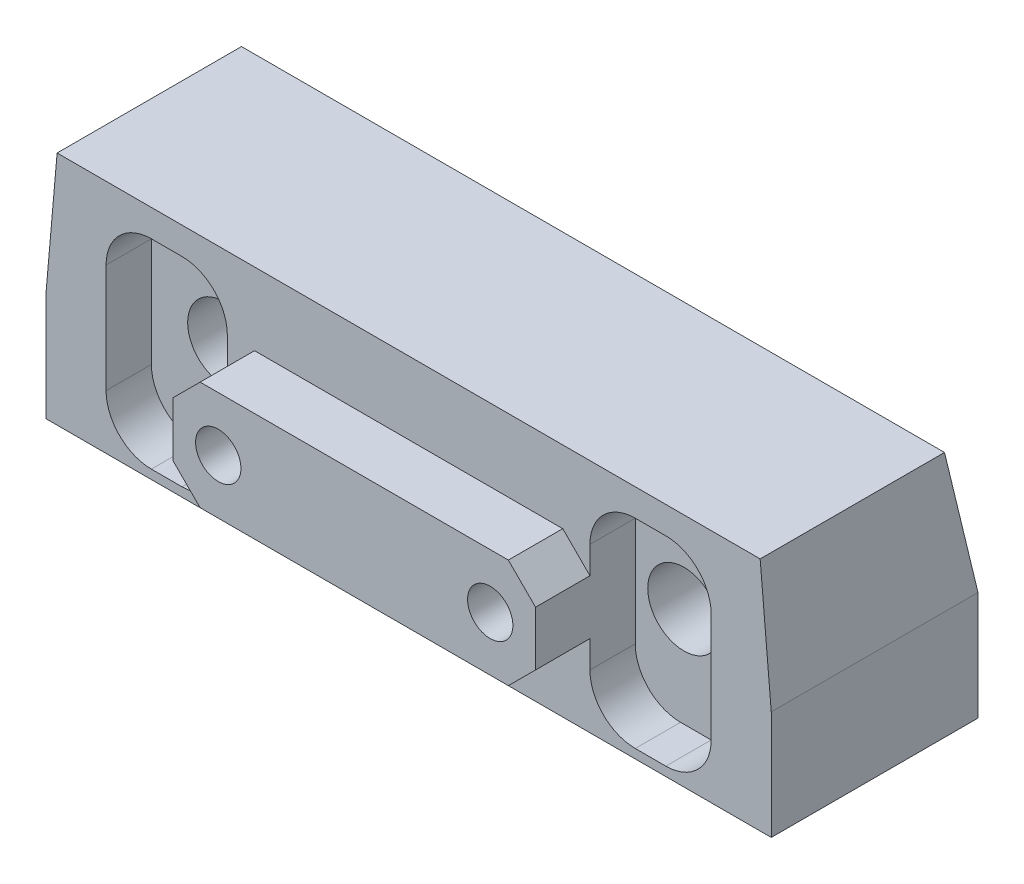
SolidWorks part; units mm, degrees
ref_plane "Plan de face" through (0, 0, 0) normal (0, 0, 1) x (1, 0, 0)
ref_plane "Plan de dessus" through (0, 0, 0) normal (0, 1, 0) x (1, 0, 0)
ref_plane "Plan de droite" through (0, 0, 0) normal (1, 0, 0) x (0, 0, -1)
imported_body "Importée3"
sketch "Esquisse1" plane through (0, 0, 131.6632) normal (0, 0, 1) x (1, 0, 0)
  line L0 (-40, -4.5675) -> (-40, 0)
  line L1 (-40, 0) -> (-38.7752, 14)
  line L2 (-38.7752, 14) -> (38.7752, 14)
  line L3 (38.7752, 14) -> (40, 0)
  line L4 (40, 0) -> (40, -4.5675)
  line L5 (40, -4.5675) -> (-40, -4.5675)
extrude "Boss.-Extru.1" add sketch "Esquisse1" along normal blind 20.3368
sketch "Esquisse2" plane through (0, -4.5675, 0) normal (0, -1, 0) x (1, 0, 0)
  line L0 (40, 152) -> (40, 129.1946)
  line L1 (40, 129.1946) -> (-40, 129.1946)
  line L2 (-40, 129.1946) -> (-40, 152)
  line L3 (-40, 152) -> (40, 152)
extrude "Boss.-Extru.2" add sketch "Esquisse2" along normal blind 7.4325
sketch "Esquisse3" plane through (0, 0, 152) normal (0, 0, 1) x (1, 0, 0)
  line L0 (-33.375, 11) -> (-33.375, -11)
  line L1 (-33.375, -11) -> (-20, -11)
  line L2 (-20, -11) -> (-20, 11)
  line L3 (-20, 11) -> (-33.375, 11)
  dimension "D1" = 22
  dimension "D2" = 13.375
  dimension "D3" = 20
  dimension "D4" = 11
extrude "Enlèv. mat.-Extru.1" cut sketch "Esquisse3" against normal blind 5
sketch "Esquisse4" plane through (0, 0, 152) normal (0, 0, 1) x (1, 0, 0)
  line L0 (-20, 6) -> (20, 6)
  line L1 (20, 6) -> (20, -6)
  line L2 (20, -6) -> (-20, -6)
  line L3 (-20, -6) -> (-20, 6)
extrude "Boss.-Extru.3" add sketch "Esquisse4" along normal blind 6
sketch "Esquisse5" plane through (0, 0, 152) normal (0, 0, 1) x (1, 0, 0)
  line L0 (33.375, 11) -> (20, 11)
  line L1 (20, 11) -> (20, -11)
  line L2 (20, -11) -> (33.375, -11)
  line L3 (33.375, -11) -> (33.375, 11)
extrude "Enlèv. mat.-Extru.2" cut sketch "Esquisse5" against normal blind 5
sketch "Esquisse6" plane through (0, 0, 130) normal (0, 0, -1) x (-1, 0, 0)
  line L0 (-14.1657, -2.5818) -> (-19.9083, -2.5818)
  line L1 (-19.9083, 2.5818) -> (-14.1657, 2.5818)
  line L2 (-14.1657, 2.5818) -> (-14.1657, -2.5818)
  arc A0 (-19.9083, -2.5818) -> (-19.9083, 2.5818) centre (-25.375, 0) ccw
extrude "Boss.-Extru.4" add sketch "Esquisse6" along normal blind 5.075 draft 0.5
sketch "Esquisse7" plane through (0, 0, 130) normal (0, 0, -1) x (-1, 0, 0)
  line L0 (14.1657, 2.5818) -> (19.9083, 2.5818)
  line L1 (19.9083, -2.5818) -> (14.1657, -2.5818)
  line L2 (14.1657, -2.5818) -> (14.1657, 2.5818)
  arc A0 (19.9083, 2.5818) -> (19.9083, -2.5818) centre (25.375, 0) ccw
extrude "Boss.-Extru.5" add sketch "Esquisse7" along normal blind 5.075 draft 0.5
hole_wizard "Perçage1" positions "Esquisse9" profile "Esquisse8" legacy
sketch "Esquisse9" plane through (0, 0, 130) normal (0, 0, -1) x (-1, 0, 0)
  point P0 (25.375, 0)
sketch "Esquisse8" plane through (-25.375, 0, 130) normal (1, 0, 0) x (0, 1, 0)
  line L0 (0, 0) -> (0, 28)
  line L1 (0, 28) -> (4, 28)
  line L2 (4, 28) -> (4, 0)
  line L3 (4, 0) -> (0, 0)
  line L4 (0, 110) -> (0, -10) construction
  dimension "Diamètre" = 8
  dimension "Profondeur" = 28
hole_wizard "Perçage2" positions "Esquisse11" profile "Esquisse10" legacy
sketch "Esquisse11" plane through (0, 0, 130) normal (0, 0, -1) x (-1, 0, 0)
  point P0 (-25.375, 0)
sketch "Esquisse10" plane through (25.375, 0, 130) normal (1, 0, 0) x (0, 1, 0)
  line L0 (0, 0) -> (0, 28)
  line L1 (0, 28) -> (4, 28)
  line L2 (4, 28) -> (4, 0)
  line L3 (4, 0) -> (0, 0)
  line L4 (0, 110) -> (0, -10) construction
  dimension "Diamètre" = 8
  dimension "Profondeur" = 28
hole_wizard "Perçage3" positions "Esquisse13" profile "Esquisse12" legacy
sketch "Esquisse13" plane through (0, 0, 158) normal (0, 0, 1) x (1, 0, 0)
  point P0 (15, 0)
sketch "Esquisse12" plane through (15, 0, 158) normal (1, 0, 0) x (0, -1, 0)
  line L0 (0, 0) -> (0, 17.6906)
  line L1 (0, 17.6906) -> (2.5, 16.2472)
  line L2 (2.5, 16.2472) -> (2.5, 0)
  line L4 (2.5, 0) -> (0, 0)
  line L6 (0, 17.6906) -> (-2.5, 16.2472) construction
  line L7 (0, -4.2442) -> (0, 117.3081) construction
  dimension "Diamètre" = 5
  dimension "Profondeur" = 16.2472
  dimension "Angle" = 120
hole_wizard "Perçage4" positions "Esquisse15" profile "Esquisse14" legacy
sketch "Esquisse15" plane through (0, 0, 158) normal (0, 0, 1) x (1, 0, 0)
  point P0 (-15, 0)
sketch "Esquisse14" plane through (-15, 0, 158) normal (1, 0, 0) x (0, -1, 0)
  line L0 (0, 0) -> (0, 17.6906)
  line L1 (0, 17.6906) -> (2.5, 16.2472)
  line L2 (2.5, 16.2472) -> (2.5, 0)
  line L4 (2.5, 0) -> (0, 0)
  line L6 (0, 17.6906) -> (-2.5, 16.2472) construction
  line L7 (0, -4.2442) -> (0, 117.3081) construction
  dimension "Diamètre" = 5
  dimension "Profondeur" = 16.2472
  dimension "Angle" = 120
chamfer "Chanfrein1" distance 3 angle 45 1 edges
chamfer "Chanfrein2" distance 3 angle 45 1 edges
chamfer "Chanfrein3" distance 3 angle 45 1 edges at (20, 6, 155)
chamfer "Chanfrein4" distance 3 angle 45 1 edges at (20, -6, 155)
fillet "Congé1" radius 0.5 1 edges
fillet "Congé2" radius 0.5 1 edges
fillet "Congé3" radius 0.5 8 edges at (-14.1879, -2.5596, 127.4625) (-17.0244, -2.5375, 124.925) (-14.21, 0, 124.925) (-19.285, 0, 124.925) (-14.1879, 2.5596, 127.4625) (-17.0244, 2.5375, 124.925)
fillet "Congé4" radius 0.5 8 edges at (14.1879, -2.5596, 127.4625) (14.1879, 2.5596, 127.4625) (14.21, 0, 124.925) (17.0244, -2.5375, 124.925) (17.0244, 2.5375, 124.925) (19.285, 0, 124.925)
fillet "Congé5" radius 3.045 1 edges
fillet "Congé6" radius 3.045 1 edges
fillet "Congé7" radius 5 1 edges at (-20, 11, 149.5)
fillet "Congé8" radius 5 1 edges at (20, 11, 149.5)
fillet "Congé9" radius 5 1 edges at (33.375, 11, 149.5)
fillet "Congé10" radius 5 1 edges at (-20, -11, 149.5)
fillet "Congé11" radius 5 1 edges at (33.375, -11, 149.5)
fillet "Congé12" radius 5 1 edges at (-33.375, 11, 149.5)
fillet "Congé13" radius 5 1 edges at (-33.375, -11, 149.5)
fillet "Congé14" radius 5 1 edges at (20, -11, 149.5)
